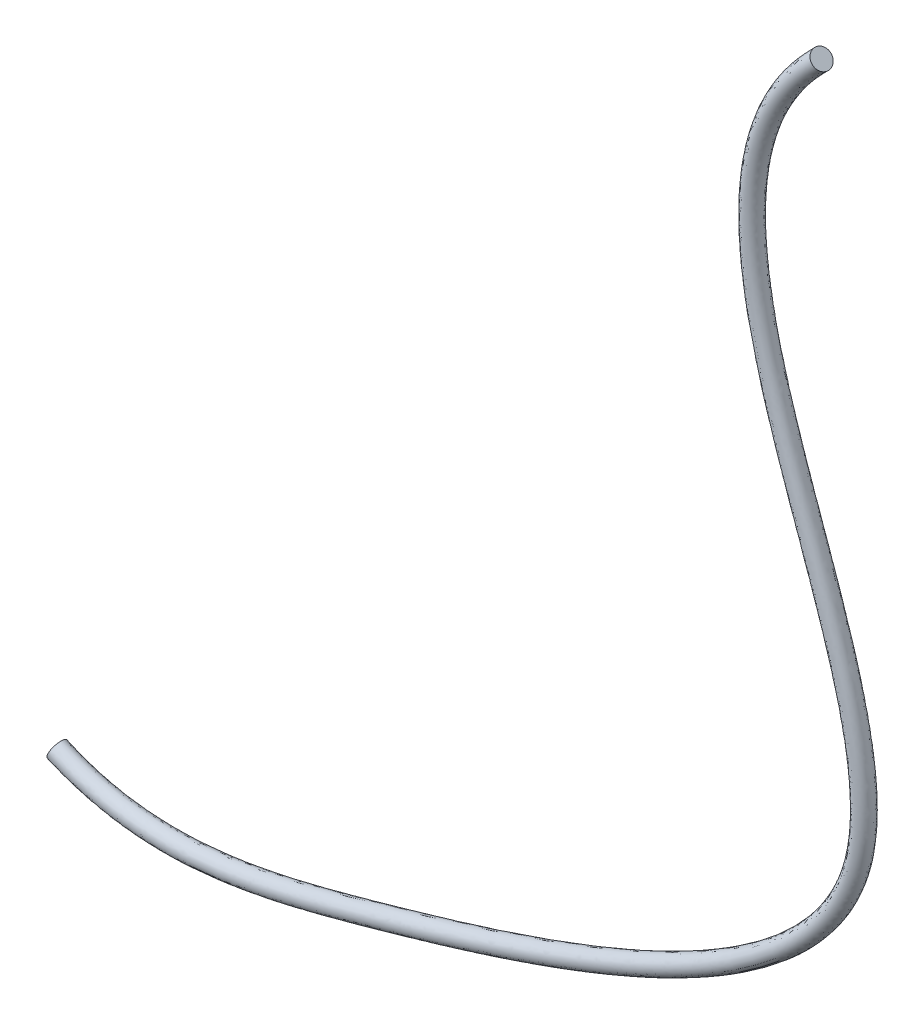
SolidWorks part; units mm, degrees
ref_plane "Front Plane" through (0, 0, 0) normal (0, 0, 1) x (1, 0, 0)
ref_plane "Top Plane" through (0, 0, 0) normal (0, 1, 0) x (1, 0, 0)
ref_plane "Right Plane" through (0, 0, 0) normal (1, 0, 0) x (0, 0, -1)
sketch "Sketch1" plane through (0, 0, 0) normal (0, 0, 1) x (1, 0, 0)
  spline S0 degree 3 poles (-44.9049, 17.532) (-39.8423, 15.279) (-24.5815, 18.954) (11.2007, 30.8771) (-14.839, 59.115) (-4.72, 69.0298) knots 0 0 0 0 0.199657 0.558054 1 1 1 1
ref_plane "Plane1" through (-4.72, 69.0298, 0) normal (0.7143, 0.6999, 0) x (0, 0, -1)
sketch "Sketch2" plane through (-4.72, 69.0298, 0) normal (0.7143, 0.6999, 0) x (0, 0, -1)
  line L0 (0, 0) -> (0, -28.2118) construction
  circle A0 centre (0, 0) radius 0.5
  dimension "D1" = 1
sweep "Sweep1" add profiles "Sketch2" path "Sketch1"
